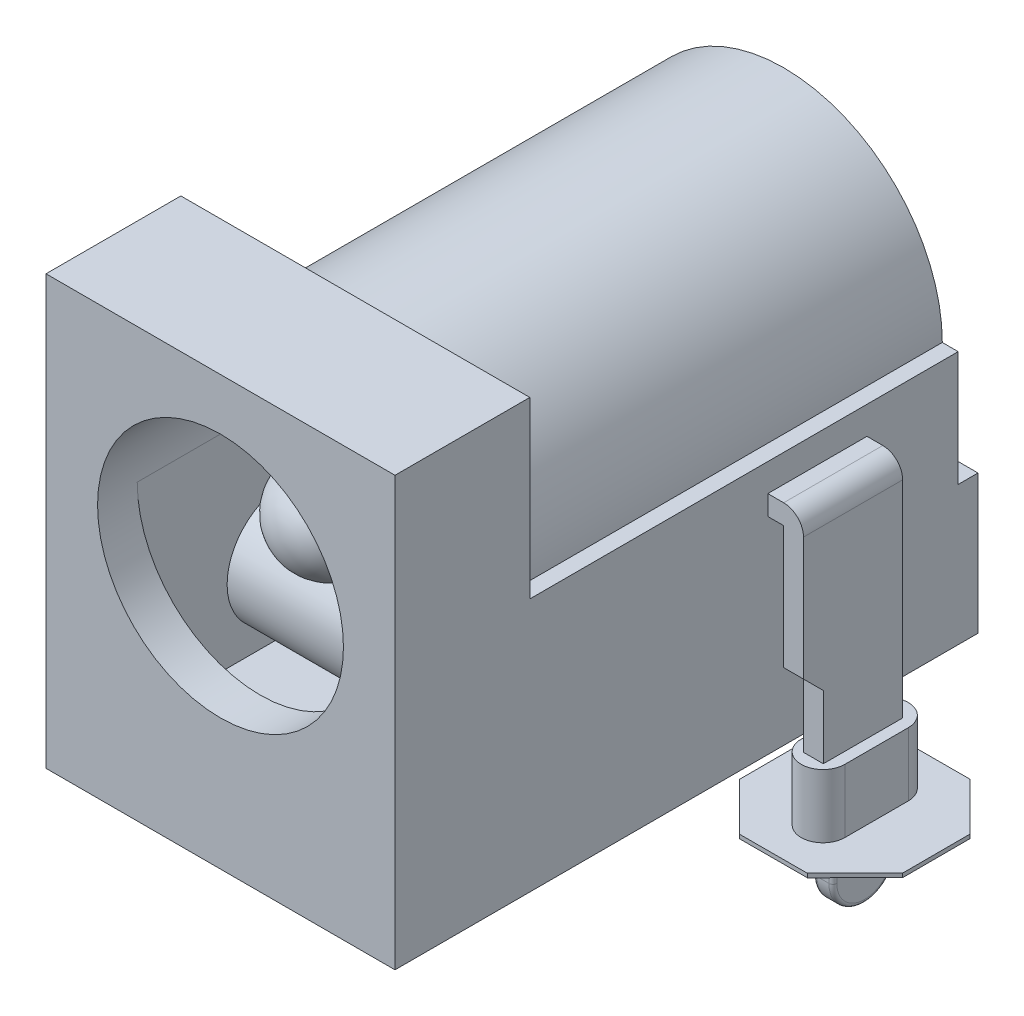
SolidWorks part; units mm, degrees
ref_plane "Plan de face" through (0, 0, 0) normal (0, 0, 1) x (1, 0, 0)
ref_plane "Plan de dessus" through (0, 0, 0) normal (0, 1, 0) x (1, 0, 0)
ref_plane "Plan de droite" through (0, 0, 0) normal (1, 0, 0) x (0, 0, -1)
sketch "Esquisse1" plane through (0, 0, 0) normal (0, 0, 1) x (1, 0, 0)
  line L1 (0, 0) -> (8.8, 0)
  line L2 (0, 0) -> (0, 10.8)
  line L3 (0, 10.8) -> (8.8, 10.8)
  line L4 (8.8, 0) -> (8.8, 10.8)
  dimension "D1" = 8.8
  dimension "D2" = 10.8
extrude "Boss.-Extru.1" add sketch "Esquisse1" along normal blind 2.4
sketch "Esquisse3" plane through (0, 0, 0) normal (0, 0, -1) x (-1, 0, 0)
  line L0 (-8.4, 6.4) -> (-8.4, 0)
  line L1 (0, 0) -> (-8.8, 0) construction
  line L2 (-8.4, 0) -> (-0.4, 0)
  line L3 (-0.4, 0) -> (-0.4, 6.4)
  line L4 (-8.8, 10.8) -> (0, 10.8) construction
  line L5 (-8.8, 0) -> (-8.8, 10.8) construction
  line L6 (0, 10.8) -> (0, 0) construction
  arc A0 (-8.4, 6.4) -> (-0.4, 6.4) centre (-4.4, 6.4) cw
  dimension "D1" = 4
  dimension "D2" = 4.4
  dimension "D3" = 0.4
  dimension "D4" = 0.4
extrude "Boss.-Extru.2" add sketch "Esquisse3" along normal blind 10.8
sketch "Esquisse4" plane through (0, 0, 0) normal (0, 0, -1) x (-1, 0, 0)
  line L1 (-8.8, 0) -> (-8.4, 0)
  line L2 (-8.8, 0) -> (-8.8, 6.4)
  line L3 (-8.8, 6.4) -> (-8.4, 6.4)
  line L4 (-8.4, 0) -> (-8.4, 6.4)
  line L5 (0, 0) -> (-0.4, 0)
  line L6 (0, 0) -> (0, 6.4)
  line L7 (0, 6.4) -> (-0.4, 6.4)
  line L8 (-0.4, 0) -> (-0.4, 6.4)
extrude "Boss.-Extru.3" add sketch "Esquisse4" along normal up to surface (10.8 mm away)
sketch "Esquisse5" plane through (0, 0, 2.4) normal (0, 0, 1) x (1, 0, 0)
  line L0 (8.8, 10.8) -> (0, 10.8) construction
  line L1 (1.3, 6.4) -> (1.3, 1.2)
  line L2 (1.3, 1.2) -> (7.5, 1.2)
  line L3 (7.5, 1.2) -> (7.5, 6.4)
  line L4 (0, 0) -> (8.8, 0) construction
  arc A1 (1.3, 6.4) -> (7.5, 6.4) centre (4.4, 6.4) cw
  point P4 (4.4, 10.8)
  dimension "D1" = 6.2
  dimension "D4" = 3.1
  dimension "D2" = 4.4
  dimension "D3" = 1.2
extrude "Enlèv. mat.-Extru.1" cut sketch "Esquisse5" against normal blind 9.5
sketch "Esquisse9" plane through (0, 0, -7.1) normal (0, 0, 1) x (1, 0, 0)
  circle A0 centre (4.4, 6.4) radius 1.25
  dimension "D1" = 2.5
extrude "Boss.-Extru.7" add sketch "Esquisse9" along normal blind 9
fillet "Congé2" radius 1.25 1 edges at (5.65, 6.4, 1.9)
sketch "Esquisse10" plane through (0, 0, 2.4) normal (0, 0, 1) x (1, 0, 0)
  line L1 (0, 10.8) -> (8.8, 10.8)
  line L2 (0, 10.8) -> (0, 0)
  line L3 (0, 0) -> (8.8, 0)
  line L4 (8.8, 10.8) -> (8.8, 0)
  circle A0 centre (4.4, 6.4) radius 3.1
extrude "Boss.-Extru.8" add sketch "Esquisse10" along normal blind 1
sketch "Esquisse11" plane through (0, 0, -10.8) normal (0, 0, -1) x (-1, 0, 0)
  line L0 (-8.8, 0) -> (0, 0) construction
  line L1 (-5.9, 0) -> (-2.9, 0)
  line L2 (-5.9, 0) -> (-5.9, 5.0771)
  line L4 (-2.9, 0) -> (-2.9, 5.0771)
  arc A0 (-5.9, 5.0771) -> (-2.9, 5.0771) centre (-4.4, 6.4) cw
  point P6 (-4.4, 6.7635)
  point P8 (-4.4, 0)
  point P9 (-4.4, 0)
  dimension "D2" = 2
  dimension "D1" = 3
extrude "Boss.-Extru.9" add sketch "Esquisse11" along normal blind 0.3
sketch "Esquisse12" plane through (0, 0, -11.1) normal (0, 0, -1) x (-1, 0, 0)
  circle A0 centre (-4.4, 6.4) radius 1.8
  dimension "D1" = 3.6
extrude "Boss.-Extru.10" add sketch "Esquisse12" along normal blind 0.5
sketch "Esquisse13" plane through (0, 0, -11.6) normal (0, 0, -1) x (-1, 0, 0)
  circle A0 centre (-4.4, 6.4) radius 1
  dimension "D1" = 2
extrude "Enlèv. mat.-Extru.2" cut sketch "Esquisse13" against normal blind 1
fillet "Congé7" radius 1 1 edges at (3.4, 6.4, -10.6)
sketch "Esquisse14" plane through (0, 0, -10.8) normal (0, 0, -1) x (-1, 0, 0)
  line L0 (-5.9, 5.0771) -> (-5.9, 0) construction
  line L1 (-8.8, 0) -> (-5.9, 0)
  line L2 (-8.8, 0) -> (-8.8, 3.5)
  line L3 (-8.8, 3.5) -> (-5.9, 3.5)
  line L4 (-5.9, 0) -> (-5.9, 3.5)
  line L5 (-2.9, 0) -> (-2.9, 5.0771) construction
  line L6 (0, 0) -> (-2.9, 0)
  line L7 (0, 0) -> (0, 3.5)
  line L8 (0, 3.5) -> (-2.9, 3.5)
  line L9 (-2.9, 0) -> (-2.9, 3.5)
  dimension "D1" = 3.5
extrude "Boss.-Extru.11" add sketch "Esquisse14" along normal blind 0.5
sketch "Esquisse15" plane through (0, 0, 0) normal (0, -1, 0) x (1, 0, 0)
  line L0 (8.8, -11.3) -> (5.9, -11.3) construction
  line L1 (9.2, -6.5) -> (9.7, -6.5)
  line L2 (9.2, -6.5) -> (9.2, -8.5)
  line L3 (9.2, -8.5) -> (9.7, -8.5)
  line L4 (9.7, -6.5) -> (9.7, -8.5)
  line L5 (8.8, 3.4) -> (8.8, -11.3) construction
  dimension "D1" = 0.5
  dimension "D2" = 2
  dimension "D3" = 2.8
  dimension "D4" = 0.4
extrude "Boss.-Extru.12" add sketch "Esquisse15" against normal blind 1.6 separate body
sketch "Esquisse16" plane through (9.7, 0, 0) normal (1, 0, 0) x (0, 0, -1)
  line L0 (6.5, 1.6) -> (6, 2.1)
  line L1 (6, 2.1) -> (6, 5.2)
  line L2 (6, 5.2) -> (8.5, 5.2)
  line L3 (8.5, 5.2) -> (8.5, 1.6)
  line L4 (8.5, 1.6) -> (6.5, 1.6)
  line L5 (8.5, 0) -> (6.5, 0) construction
  dimension "D1" = 5.2
  dimension "D2" = 2.5
  dimension "D3" = 135
extrude "Boss.-Extru.13" add sketch "Esquisse16" against normal blind 0.5
sketch "Esquisse17" plane through (9.7, 0, 0) normal (1, 0, 0) x (0, 0, -1)
  line L1 (6, 5.2) -> (8.5, 5.2)
  line L2 (6, 5.2) -> (6, 5.7)
  line L3 (6, 5.7) -> (8.5, 5.7)
  line L4 (8.5, 5.2) -> (8.5, 5.7)
  line L7 (8.5, 5.2) -> (8.5, 0) construction
  dimension "D1" = 0.5
extrude "Boss.-Extru.14" add sketch "Esquisse17" against normal blind 9.5
fillet "Congé9" radius 0.5 1 edges at (9.7, 5.7, -7.25)
sketch "Esquisse18" plane through (1.3, 0, 0) normal (1, 0, 0) x (0, 0, -1)
  line L0 (7.1, 4.5297) -> (1.3666, 4.5297)
  line L1 (7.1, 1.2) -> (7.1, 5.2) construction
  line L2 (7.1, 4.2297) -> (1.3666, 4.2297)
  line L3 (7.1, 1.8297) -> (1.3666, 1.8297)
  line L4 (7.1, 1.5297) -> (1.3666, 1.5297)
  line L5 (7.1, 4.5297) -> (7.1, 4.2297)
  line L6 (7.1, 1.8297) -> (7.1, 1.5297)
  arc A0 (1.3666, 4.5297) -> (1.3666, 1.5297) centre (1.3666, 3.0297) ccw
  arc A1 (1.3666, 4.2297) -> (1.3666, 1.8297) centre (1.3666, 3.0297) ccw
  dimension "D1" = 0.3
  dimension "D2" = 0.3
  dimension "D3" = 3
extrude "Boss.-Extru.15" add sketch "Esquisse18" along normal blind 6.5
sketch "Esquisse19" plane through (0, 0, 0) normal (0, -1, 0) x (1, 0, 0)
  line L0 (4.4, -11.1) -> (4.4, 1.8001) construction
  line L1 (5.9, -11.1) -> (2.9, -11.1) construction
  line L2 (3.6, -11.1) -> (5.2, -11.1)
  line L3 (3.6, -10) -> (5.2, -10)
  line L4 (3.6, -4) -> (5.2, -4)
  line L5 (3.6, -5.1) -> (5.2, -5.1)
  line L6 (9.9833, -6.7589) -> (9.9833, -8.3589)
  line L7 (8.8833, -6.7589) -> (8.8833, -8.3589)
  arc A0 (3.6, -11.1) -> (3.6, -10) centre (3.6, -10.55) cw
  arc A1 (5.2, -11.1) -> (5.2, -10) centre (5.2, -10.55) ccw
  arc A2 (3.6, -5.1) -> (3.6, -4) centre (3.6, -4.55) cw
  arc A3 (5.2, -5.1) -> (5.2, -4) centre (5.2, -4.55) ccw
  arc A4 (9.9833, -6.7589) -> (8.8833, -6.7589) centre (9.4333, -6.7589) ccw
  arc A5 (9.9833, -8.3589) -> (8.8833, -8.3589) centre (9.4333, -8.3589) cw
  dimension "D1" = 0.55
  dimension "D4" = 0.55
  dimension "D2" = 0.8
  dimension "D3" = 0.8
  dimension "D5" = 6
extrude "Boss.-Extru.16" add sketch "Esquisse19" along normal blind 1.6
sketch "Esquisse20" plane through (0, -1.6, 0) normal (0, -1, 0) x (1, 0, 0)
  line L0 (4.4, -4) -> (4.4, -5.1) construction
  line L1 (5.2, -4) -> (3.6, -4) construction
  line L2 (3.6, -5.1) -> (5.2, -5.1) construction
  line L3 (4.4, -10) -> (4.4, -11.1) construction
  line L4 (5.2, -10) -> (3.6, -10) construction
  line L5 (3.6, -11.1) -> (5.2, -11.1) construction
  line L6 (9.9833, -7.5589) -> (8.8833, -7.5589) construction
  line L7 (9.9833, -8.3589) -> (9.9833, -6.7589) construction
  line L8 (8.8833, -6.7589) -> (8.8833, -8.3589) construction
  line L10 (6.4521, -9.7) -> (5.25, -8.4979)
  line L11 (5.25, -8.4979) -> (3.55, -8.4979)
  line L12 (3.55, -8.4979) -> (2.3479, -9.7)
  line L13 (2.3479, -9.7) -> (2.3479, -11.4)
  line L14 (2.3479, -11.4) -> (3.55, -12.6021)
  line L15 (3.55, -12.6021) -> (5.25, -12.6021)
  line L16 (5.25, -12.6021) -> (6.4521, -11.4)
  line L17 (6.4521, -11.4) -> (6.4521, -9.7)
  line L18 (6.4521, -3.7) -> (5.25, -2.4979)
  line L19 (5.25, -2.4979) -> (3.55, -2.4979)
  line L20 (3.55, -2.4979) -> (2.3479, -3.7)
  line L21 (2.3479, -3.7) -> (2.3479, -5.4)
  line L22 (2.3479, -5.4) -> (3.55, -6.6021)
  line L23 (3.55, -6.6021) -> (5.25, -6.6021)
  line L24 (5.25, -6.6021) -> (6.4521, -5.4)
  line L25 (6.4521, -5.4) -> (6.4521, -3.7)
  line L26 (11.4869, -6.7126) -> (10.287, -5.5084)
  line L27 (10.287, -5.5084) -> (8.587, -5.5053)
  line L28 (8.587, -5.5053) -> (7.3828, -6.7053)
  line L29 (7.3828, -6.7053) -> (7.3797, -8.4053)
  line L30 (7.3797, -8.4053) -> (8.5796, -9.6095)
  line L31 (8.5796, -9.6095) -> (10.2796, -9.6125)
  line L32 (10.2796, -9.6125) -> (11.4839, -8.4126)
  line L33 (11.4839, -8.4126) -> (11.4869, -6.7126)
  circle A0 centre (4.4, -10.55) radius 2.0521 construction
  circle A1 centre (4.4, -4.55) radius 2.0521 construction
  circle A2 centre (9.4333, -7.5589) radius 2.0521 construction
  dimension "D1" = 1.7
extrude "Boss.-Extru.17" add sketch "Esquisse20" along normal blind 0.1
sketch "Esquisse21" plane through (0, -1.7, 0) normal (0, -1, 0) x (1, 0, 0)
  line L0 (3.05, -4.55) -> (5.75, -4.55) construction
  line L1 (3.6, -10.3) -> (5.2, -10.3)
  line L2 (3.6, -10.3) -> (3.6, -10.8)
  line L3 (3.6, -10.8) -> (5.2, -10.8)
  line L4 (5.2, -10.3) -> (5.2, -10.8)
  line L5 (3.6, -4.3) -> (5.2, -4.3)
  line L6 (3.6, -4.3) -> (3.6, -4.8)
  line L7 (3.6, -4.8) -> (5.2, -4.8)
  line L8 (5.2, -4.3) -> (5.2, -4.8)
  line L9 (9.6833, -6.7574) -> (9.1833, -6.7574)
  line L10 (9.6833, -6.7574) -> (9.6833, -8.3574)
  line L11 (9.6833, -8.3574) -> (9.1833, -8.3574)
  line L12 (9.1833, -6.7574) -> (9.1833, -8.3574)
  line L13 (3.05, -10.55) -> (5.75, -10.55) construction
  line L14 (9.4333, -6.2089) -> (9.4333, -8.9089) construction
  arc A2 (5.2, -5.1) -> (5.2, -4) centre (5.2, -4.55) ccw construction
  arc A3 (3.6, -4) -> (3.6, -5.1) centre (3.6, -4.55) ccw construction
  arc A4 (3.6, -10) -> (3.6, -11.1) centre (3.6, -10.55) ccw construction
  arc A5 (5.2, -11.1) -> (5.2, -10) centre (5.2, -10.55) ccw construction
  arc A6 (9.9833, -6.7589) -> (8.8833, -6.7589) centre (9.4333, -6.7589) ccw construction
  arc A7 (8.8833, -8.3589) -> (9.9833, -8.3589) centre (9.4333, -8.3589) ccw construction
  point P15 (3.6, -4.55)
  point P37 (3.6, -10.55)
  point P38 (9.4333, -6.7574)
  dimension "D1" = 0.5
  dimension "D2" = 0.5
  dimension "D3" = 0.5
extrude "Boss.-Extru.18" add sketch "Esquisse21" along normal blind 1.9
fillet "Congé16" radius 0.8 6 edges at (3.6, -3.6, -4.55) (5.2, -3.6, -4.55) (9.4333, -3.6, -6.7574) (9.4333, -3.6, -8.3574) (3.6, -3.6, -10.55) (5.2, -3.6, -10.55)
fillet "Congé17" radius 0.1 8 edges at (4.9657, -3.3657, -10.3) (3.8343, -3.3657, -10.3) (4.9657, -3.3657, -10.8) (3.8343, -3.3657, -10.8) (5.2, -2.25, -10.8) (5.2, -2.25, -10.3) (3.6, -2.25, -10.3) (3.6, -2.25, -10.8)
fillet "Congé18" radius 0.1 8 edges at (9.1833, -3.3657, -8.1231) (9.1833, -3.3657, -6.9918) (9.6833, -3.3657, -6.9918) (9.6833, -3.3657, -8.1231) (9.1833, -2.25, -8.3574) (9.1833, -2.25, -6.7574) (9.6833, -2.25, -6.7574) (9.6833, -2.25, -8.3574)
fillet "Congé19" radius 0.1 8 edges at (4.9657, -3.3657, -4.8) (3.8343, -3.3657, -4.8) (3.8343, -3.3657, -4.3) (4.9657, -3.3657, -4.3) (5.2, -2.25, -4.8) (3.6, -2.25, -4.8) (3.6, -2.25, -4.3) (5.2, -2.25, -4.3)
fillet "Congé20" radius 0.25 8 edges at (5.1707, -1.7, -10.3293) (5.2, -1.7, -10.55) (5.1707, -1.7, -10.7707) (4.4, -1.7, -10.8) (3.6293, -1.7, -10.7707) (3.6, -1.7, -10.55) (3.6293, -1.7, -10.3293) (4.4, -1.7, -10.3)
fillet "Congé21" radius 0.25 8 edges at (9.654, -1.7, -8.3282) (9.4333, -1.7, -8.3574) (9.2126, -1.7, -8.3282) (9.1833, -1.7, -7.5574) (9.2126, -1.7, -6.7867) (9.4333, -1.7, -6.7574) (9.654, -1.7, -6.7867) (9.6833, -1.7, -7.5574)
fillet "Congé22" radius 0.25 8 edges at (5.1707, -1.7, -4.3293) (5.2, -1.7, -4.55) (5.1707, -1.7, -4.7707) (4.4, -1.7, -4.8) (3.6293, -1.7, -4.7707) (3.6, -1.7, -4.55) (3.6293, -1.7, -4.3293) (4.4, -1.7, -4.3)
